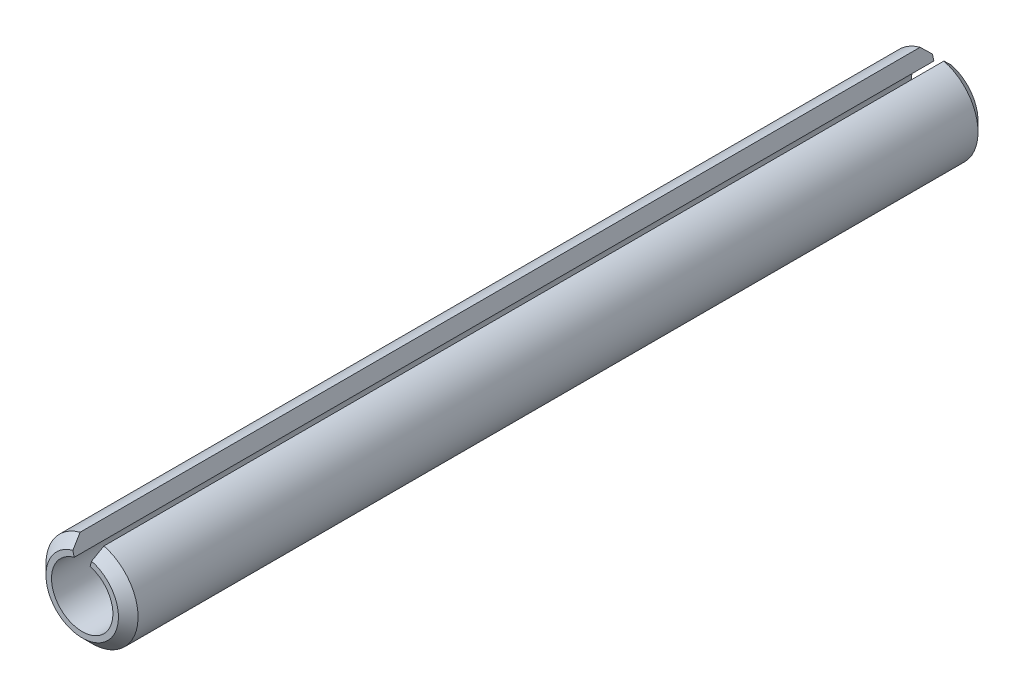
SolidWorks part; units mm, degrees
ref_plane "Front Plane" through (0, 0, 0) normal (0, 0, 1) x (1, 0, 0)
ref_plane "Top Plane" through (0, 0, 0) normal (0, 1, 0) x (1, 0, 0)
ref_plane "Right Plane" through (0, 0, 0) normal (1, 0, 0) x (0, 0, -1)
sketch "Sketch1" plane through (0, 0, 0) normal (0, 0, 1) x (1, 0, 0)
  line L0 (0.2054, 0.7667) -> (0.3082, 1.1501)
  line L1 (-0.2054, 0.7667) -> (-0.3082, 1.1501)
  line L2 (0, 0) -> (0, 2.5064) construction
  arc A0 (-0.3082, 1.1501) -> (0.3082, 1.1501) centre (0, 0) ccw
  arc A1 (-0.2054, 0.7667) -> (0.2054, 0.7667) centre (0, 0) ccw
  dimension "D1" = 2.3813
  dimension "D2" = 1.5875
  dimension "D3" = 30
extrude "Extrude1" add sketch "Sketch1" along normal mid plane 22.225
chamfer "Chamfer1" distance 0.254 angle 45 2 edges at (0, -1.1906, -11.1125) (0, -1.1906, 11.1125)
